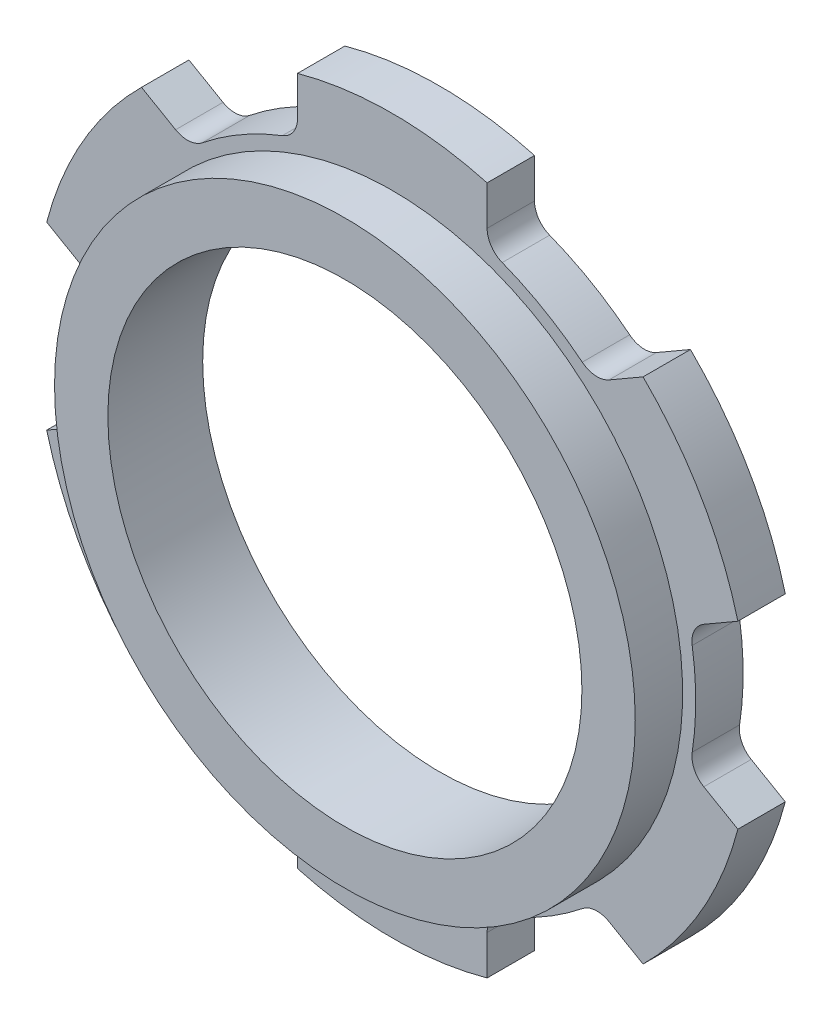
SolidWorks part; units mm, degrees
ref_plane "Plan de face" through (0, 0, 0) normal (0, 0, 1) x (1, 0, 0)
ref_plane "Plan de dessus" through (0, 0, 0) normal (0, 1, 0) x (1, 0, 0)
ref_plane "Plan de droite" through (0, 0, 0) normal (1, 0, 0) x (0, 0, -1)
sketch "Esquisse1" plane through (0, 0, 0) normal (0, 0, 1) x (1, 0, 0)
  circle A0 centre (0, 0) radius 10
  circle A1 centre (0, 0) radius 12.25
  dimension "D1" = 24.5
  dimension "D2" = 20
extrude "Extrusion1" add sketch "Esquisse1" along normal blind 2
sketch "Esquisse2" plane through (0, 0, 0) normal (0, 0, -1) x (-1, 0, 0)
  line L0 (0, 0) -> (0, 16.2679) construction
  line L2 (0, 0) -> (-4.3831, 15.9171) construction
  line L3 (4, 14.5259) -> (4, 12.1614)
  line L4 (-4, 14.5259) -> (-4, 12.1614)
  line L5 (10.5798, 10.7271) -> (8.5321, 9.5448)
  line L6 (14.5798, 3.7989) -> (12.5321, 2.6166)
  line L7 (14.5798, -3.7989) -> (12.5321, -2.6166)
  line L8 (10.5798, -10.7271) -> (8.5321, -9.5448)
  line L9 (4, -14.5259) -> (4, -12.1614)
  line L10 (-4, -14.5259) -> (-4, -12.1614)
  line L11 (-10.5798, -10.7271) -> (-8.5321, -9.5448)
  line L12 (-14.5798, -3.7989) -> (-12.5321, -2.6166)
  line L13 (-14.5798, 3.7989) -> (-12.5321, 2.6166)
  line L14 (-10.5798, 10.7271) -> (-8.5321, 9.5448)
  arc A0 (4, 14.5259) -> (-4, 14.5259) centre (0, 0) ccw
  circle A1 centre (0, 0) radius 10
  arc A2 (4, -12.1614) -> (8.5321, -9.5448) centre (0, 0) ccw
  arc A4 (11.655, 3.7715) -> (9.0937, 8.2078) centre (0, 0) ccw
  arc A5 (8.5321, 9.5448) -> (4, 12.1614) centre (0, 0) ccw
  arc A6 (14.5798, 3.7989) -> (10.5798, 10.7271) centre (0, 0) ccw
  arc A7 (12.5321, -2.6166) -> (12.5321, 2.6166) centre (0, 0) ccw
  arc A8 (10.5798, -10.7271) -> (14.5798, -3.7989) centre (0, 0) ccw
  arc A9 (-11.655, -3.7715) -> (-9.0937, -8.2078) centre (0, 0) ccw
  arc A10 (-4, -14.5259) -> (4, -14.5259) centre (0, 0) ccw
  arc A11 (-8.5321, -9.5448) -> (-4, -12.1614) centre (0, 0) ccw
  arc A12 (-14.5798, -3.7989) -> (-10.5798, -10.7271) centre (0, 0) ccw
  arc A14 (-10.5798, 10.7271) -> (-14.5798, 3.7989) centre (0, 0) ccw
  arc A15 (2.5613, 11.9792) -> (2.1272, 12.0639) centre (0, 0) ccw
  arc A16 (-4, 12.1614) -> (-8.5321, 9.5448) centre (0, 0) ccw
  arc A17 (9.0937, -8.2078) -> (11.655, -3.7715) centre (0, 0) ccw
  arc A18 (-2.5613, -11.9792) -> (2.5613, -11.9792) centre (0, 0) ccw
  arc A19 (-12.5321, 2.6166) -> (-12.5321, -2.6166) centre (0, 0) ccw
  arc A20 (-9.0937, 8.2078) -> (-11.655, 3.7715) centre (0, 0) ccw
  dimension "D1" = 4
extrude "Extrusion2" add sketch "Esquisse2" along normal blind 2
fillet "Congé1" radius 1 12 edges at (4, 12.1614, -1) (12.5321, 2.6166, -1) (4, -12.1614, -1) (8.5321, -9.5448, -1) (-8.5321, -9.5448, -1) (-4, -12.1614, -1) (-12.5321, 2.6166, -1) (-12.5321, -2.6166, -1) (-4, 12.1614, -1) (12.5321, -2.6166, -1) (8.5321, 9.5448, -1) (-8.5321, 9.5448, -1)
